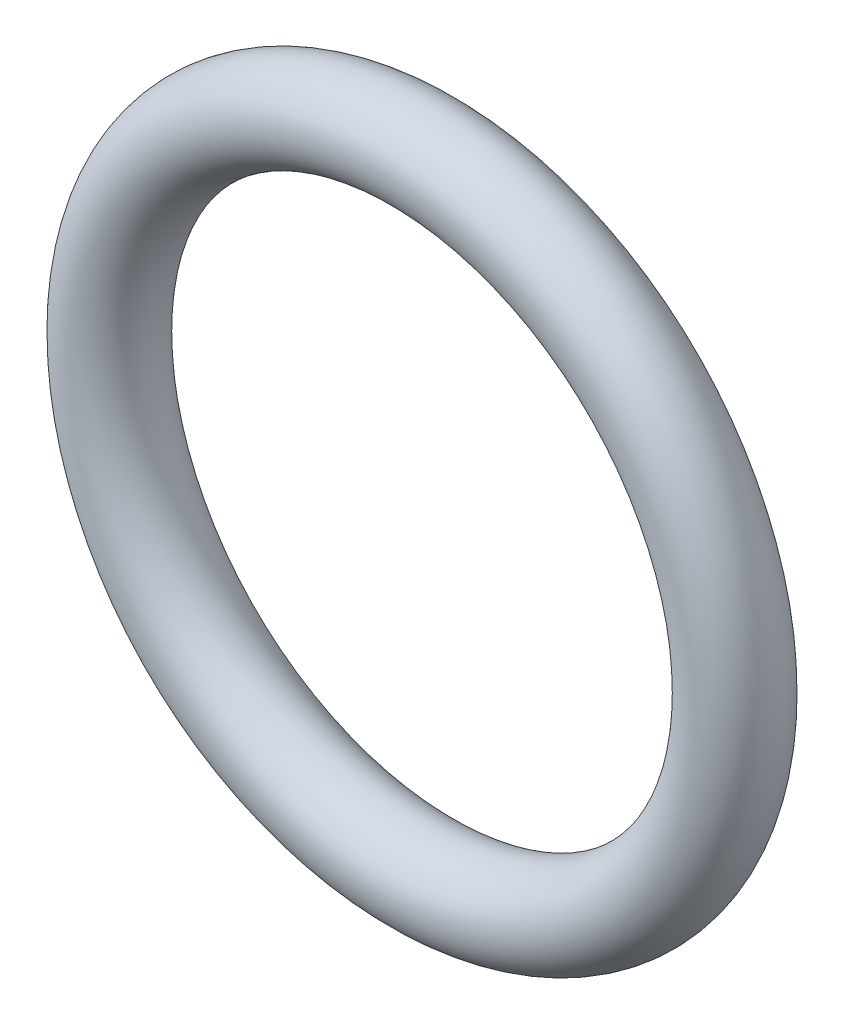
SolidWorks part; units mm, degrees
ref_plane "Front Plane" through (0, 0, 0) normal (0, 0, 1) x (1, 0, 0)
ref_plane "Top Plane" through (0, 0, 0) normal (0, 1, 0) x (1, 0, 0)
ref_plane "Right Plane" through (0, 0, 0) normal (1, 0, 0) x (0, 0, -1)
sketch "Sketch1" plane through (0, 0, 0) normal (0, 1, 0) x (1, 0, 0)
  circle A0 centre (0, 0) radius 0.889
  dimension "D1" = 1.778
sketch "Sketch3" plane through (0, 0, 0) normal (0, 0, 1) x (1, 0, 0)
  circle A0 centre (6.2992, 0) radius 6.2992
  dimension "D1" = 12.5984
sweep "Sweep1" add profiles "Sketch1" path "Sketch3"
